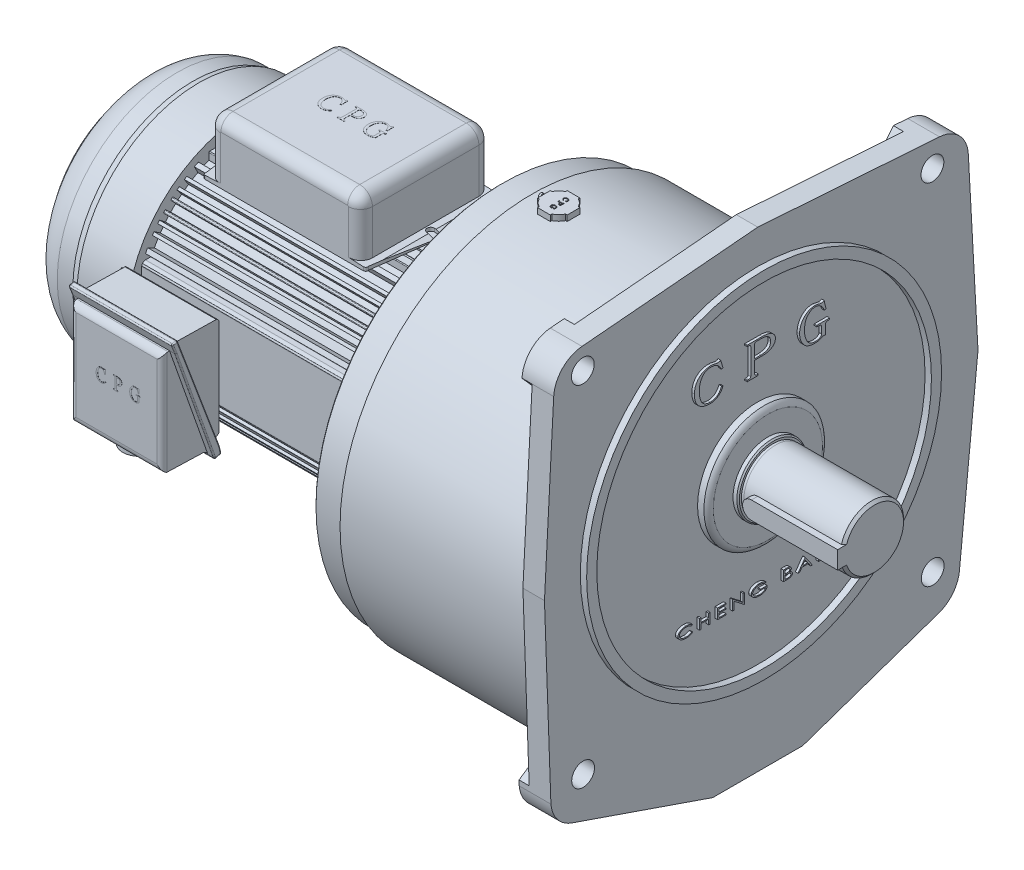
SolidWorks part; units mm, degrees
ref_plane "前基準面" through (0, 0, 0) normal (0, 0, 1) x (1, 0, 0)
ref_plane "上基準面" through (0, 0, 0) normal (0, 1, 0) x (1, 0, 0)
ref_plane "右基準面" through (0, 0, 0) normal (1, 0, 0) x (0, 0, -1)
sketch "草圖2" plane through (0, 0, 0) normal (0, 0, 1) x (1, 0, 0)
  line L0 (-161, 151.5439) -> (0, 151.5439)
  line L1 (-161, 151.5439) -> (-161, 146.5067)
  line L2 (-471, 0) -> (-471, 177.4974) construction
  line L3 (0, 0) -> (0, 151.5439)
  line L4 (-162, 147.5067) -> (-161, 146.5067)
  line L5 (-185, 146.5067) -> (-185, 124.0067)
  line L6 (-189, 123.0067) -> (-189, 105.0067)
  line L7 (-190.5, 104.0067) -> (-190.5, 90.2537)
  line L8 (-193, 90.2537) -> (-193, 83)
  line L9 (-189, 105.0067) -> (-189.5, 105.0067)
  line L10 (-189.5, 105.0067) -> (-190.5, 104.0067)
  line L11 (-190.5, 90.2537) -> (-193, 90.2537)
  line L12 (-188, 124.0067) -> (-189, 123.0067)
  line L13 (-185, 124.0067) -> (-188, 124.0067)
  line L14 (-184, 147.5067) -> (-185, 146.5067)
  line L15 (-162, 147.5067) -> (-184, 147.5067)
  line L16 (-471, 69) -> (-471, 0)
  line L17 (-204.5, 90) -> (-385, 90)
  line L18 (-385, 96) -> (-424, 96)
  line L19 (-428.8759, 94.5) -> (-441.1259, 94.5)
  line L20 (-428.8759, 94.5) -> (-424, 96)
  line L21 (-385, 96) -> (-385, 90)
  line L22 (-194, 84) -> (-196.9708, 84)
  line L23 (-515.1227, 0) -> (41.2916, 0) construction
  line L24 (-471, 0) -> (0, 0)
  line L25 (-196.9708, 84) -> (-196.9708, 85)
  arc A0 (-441.1259, 94.5) -> (-467.5, 73) centre (-435.0679, 60.142) ccw
  arc A1 (-467.5, 73) -> (-471, 69) centre (-467.2706, 69.2681) ccw
  arc A3 (-193, 83) -> (-194, 84) centre (-194, 83) ccw
  arc A4 (-204.5, 90) -> (-196.9708, 85) centre (-204.3616, 82.0396) cw
  dimension "D1" = 192
  dimension "D2" = 192
  dimension "D3" = 86
  dimension "D4" = 193
revolve "旋轉1" add sketch "草圖2" angle 360 about L23
sketch "草圖5" plane through (0, 0, 0) normal (1, 0, 0) x (0, 0, -1)
  line L0 (-260.2741, 51) -> (337.3159, 51) construction
  line L1 (166.0988, 184.8249) -> (173.7337, 46.8699)
  line L2 (-168.2663, 46.8699) -> (-163.1792, -94.766)
  line L3 (173.7337, 46.8699) -> (159.0195, -97.1828)
  line L4 (0, 0) -> (0, -245.4677) construction
  line L5 (0, 217.8699) -> (-138.6589, 205.7388)
  line L6 (-168.2663, 46.8699) -> (-160.9885, 182.6434)
  line L7 (0, 51) -> (-138, 188.7716) construction
  line L8 (0, 217.8699) -> (143.3342, 207.9121)
  line L9 (-286.7543, 0) -> (309.9532, 0) construction
  line L10 (0, 251.9137) -> (0, 51) construction
  line L14 (35.5, -154.1301) -> (-35.5, -154.1301)
  line L15 (-146.7463, -115.8249) -> (-35.5, -154.1301)
  line L16 (142.6964, -117.2194) -> (35.5, -154.1301)
  circle A0 centre (-138, 188.7716) radius 9
  circle A1 centre (0, 51) radius 195 construction
  circle A2 centre (137.7716, 189) radius 9
  circle A3 centre (138, -86.7716) radius 9
  circle A4 centre (-137.7716, -87) radius 9
  arc A5 (-138.6589, 205.7388) -> (-160.9885, 182.6434) centre (-136.5236, 181.332) ccw
  arc A6 (-163.1792, -94.766) -> (-146.7463, -115.8249) centre (-138.7699, -92.6597) ccw
  arc A7 (159.0195, -97.1828) -> (142.6964, -117.2194) centre (134.72, -94.0542) cw
  arc A8 (143.3342, 207.9121) -> (166.0988, 184.8249) centre (141.6362, 183.471) cw
  dimension "D4" = 18
  dimension "D5" = 24.5
  dimension "D3" = 390
  dimension "D2" = 342
  dimension "D9" = 372
  dimension "D11" = 138
ref_plane "平面1" through (0, 51, 0) normal (0, 1, 0) x (-1, 0, 0)
extrude "伸長1" add sketch "草圖5" along normal blind 17
sketch "草圖6" plane through (17, 0, 0) normal (1, 0, 0) x (0, 0, -1)
  circle A0 centre (0, 51) radius 140
  circle A1 centre (0, 51) radius 132
  dimension "D1" = 280
  dimension "D2" = 264
extrude "伸長2" add sketch "草圖6" along normal blind 5
sketch "草圖7" plane through (0, 0, 0) normal (0, 0, 1) x (1, 0, 0)
  line L0 (109, 51) -> (130.8468, 51) construction
  line L1 (31, 76) -> (106.985, 76)
  line L2 (106.985, 76) -> (31, 76)
  line L3 (22, 98.5) -> (17, 98.5)
  line L4 (29, 75.9) -> (29, 77.5)
  line L5 (31, 75.9) -> (31, 76)
  line L6 (24.985, 94.0279) -> (24.985, 78.5)
  line L7 (29, 75.9) -> (31, 75.9)
  line L8 (31, 75.9) -> (29, 75.9)
  line L9 (29, 77.5) -> (29, 75.9)
  line L10 (28, 78.5) -> (29, 77.5)
  line L11 (24.985, 78.5) -> (28, 78.5)
  line L12 (29, 77.5) -> (28, 78.5)
  line L13 (28, 78.5) -> (24.985, 78.5)
  line L14 (31, 75.9) -> (31, 76)
  line L15 (109, 51) -> (109, 74)
  line L16 (106.985, 76) -> (109, 74)
  line L17 (109, 74) -> (106.985, 76)
  line L18 (17, 46.8699) -> (17, 182.6434) construction
  line L20 (17, 98.5) -> (17, 51)
  line L22 (17, 51) -> (109, 51)
  line L23 (17, 217.8699) -> (17, 207.9121) construction
  line L25 (0, 151.5439) -> (0, -151.5439) construction
  arc A0 (24.985, 94.0279) -> (22, 98.5) centre (17.9603, 92.5714) ccw
  point P20 (0, 0)
  dimension "D1" = 50
  dimension "D2" = 80
  dimension "D3" = 92
  dimension "D4" = 51
  dimension "D5" = 55
revolve "旋轉2" add sketch "草圖7" angle 360 about L0
sketch "草圖12"
extrude "伸長7" add sketch "草圖12" along normal blind 2
sketch "草圖13" plane through (0, 0, 0) normal (-1, 0, 0) x (0, 0, 1)
  line L0 (-166.0988, 184.8249) -> (-101.5392, 112.496)
  line L1 (-131.988, 208.7004) -> (-72.023, 133.3351)
  line L2 (0, 217.8699) -> (-143.3342, 207.9121) construction
  line L3 (160.9885, 182.6434) -> (100.4476, 113.4718)
  line L4 (127.6635, 206.7008) -> (69.6783, 134.5752)
  line L5 (0, 217.8699) -> (138.6589, 205.7388) construction
  line L6 (-142.6964, -117.2194) -> (-117.1838, -96.0912)
  line L7 (-160.0698, -86.8998) -> (-135.2344, -68.3903)
  line L8 (-173.7337, 46.8699) -> (-159.0195, -97.1828) construction
  line L9 (146.7463, -115.8249) -> (117.1838, -96.0912)
  line L10 (163.3273, -90.6426) -> (134.1014, -70.586)
  line L12 (168.2663, 46.8699) -> (163.1792, -94.766) construction
  line L13 (163.3273, -90.6426) -> (163.1792, -94.766)
  line L14 (-160.0698, -86.8998) -> (-159.0195, -97.1828)
  line L15 (-131.988, 208.7004) -> (-143.3342, 207.9121)
  line L16 (127.6635, 206.7008) -> (138.6589, 205.7388)
  circle A0 centre (0, 0) radius 151.5439 construction
  circle A1 centre (0, 0) radius 151.5439 construction
  arc A2 (146.7463, -115.8249) -> (163.1792, -94.766) centre (138.7699, -92.6597) ccw construction
  arc A3 (-159.0195, -97.1828) -> (-142.6964, -117.2194) centre (-134.72, -94.0542) ccw construction
  arc A4 (146.7463, -115.8249) -> (163.1792, -94.766) centre (138.7699, -92.6597) ccw
  arc A5 (-159.0195, -97.1828) -> (-142.6964, -117.2194) centre (-134.72, -94.0542) ccw
  arc A6 (-143.3342, 207.9121) -> (-166.0988, 184.8249) centre (-141.6362, 183.471) ccw construction
  arc A7 (160.9885, 182.6434) -> (138.6589, 205.7388) centre (136.5236, 181.332) ccw construction
  arc A8 (-143.3342, 207.9121) -> (-166.0988, 184.8249) centre (-141.6362, 183.471) ccw
  arc A9 (160.9885, 182.6434) -> (138.6589, 205.7388) centre (136.5236, 181.332) ccw
  arc A10 (117.1838, -96.0912) -> (134.1014, -70.586) centre (0, 0) ccw
  arc A11 (100.4476, 113.4718) -> (69.6783, 134.5752) centre (0, 0) ccw
  arc A12 (-72.023, 133.3351) -> (-101.5392, 112.496) centre (0, 0) ccw
  arc A13 (-135.2344, -68.3903) -> (-117.1838, -96.0912) centre (0, 0) ccw
  circle A17 centre (-137.7716, 189) radius 9 construction
  circle A18 centre (-137.7716, 189) radius 9
  circle A19 centre (138, 188.7716) radius 9 construction
  circle A21 centre (138, 188.7716) radius 9
  circle A22 centre (137.7716, -87) radius 9 construction
  circle A23 centre (137.7716, -87) radius 9
  circle A24 centre (-138, -86.7716) radius 9 construction
  circle A25 centre (-138, -86.7716) radius 9
extrude "伸長13" add sketch "草圖13" along normal blind 8
ref_plane "平面5" through (0, 0, 0) normal (0, 0.5736, 0.8192) x (1, 0, 0)
sketch "草圖17" plane through (0, 0, 0) normal (0, 0.5736, 0.8192) x (1, 0, 0)
  line L0 (-8, 150.5324) -> (-8, 246.6625) construction
  arc A0 (-8, 198.5975) -> (-64.3921, 150.1512) centre (-78.6138, 223.7492) cw
rib "肋材1" sketch "草圖17" sketch "草圖17" thickness 13 extrusion direction parallel to sketch draft on no parameters "D1"=13
pattern_circular "環狀複製排列1" count 2 every 70 about axis through (-515.1227, 0, 0) along (-1, 0, 0) of "肋材1"
sketch "草圖19" plane through (0, 0, 0) normal (0, 0, 1) x (1, 0, 0)
  line L0 (-12.8358, 51) -> (184.7096, 51) construction
  line L1 (109, 28) -> (109, 74) construction
  line L2 (109, 44) -> (109, 58)
  line L3 (163, 51) -> (163, 90.2692) construction
  line L4 (109, 58) -> (41, 58)
  line L5 (41, 44) -> (109, 44)
  line L7 (34, 51) -> (34, 91.2981) construction
  arc A0 (41, 58) -> (41, 44) centre (41, 51) ccw
  dimension "D1" = 25
  dimension "D2" = 54
  dimension "D3" = 75
  dimension "D4" = 14
  dimension "D5" = 7
extrude "伸長14" add sketch "草圖19" along normal blind 29
ref_plane "平面6" through (0, 0, 146) normal (0, 0, 1) x (1, 0, 0)
sketch "草圖30" plane through (-385, 0, 0) normal (1, 0, 0) x (0, 0, -1)
  line L1 (83.9768, 30.5) -> (84, 25)
  line L2 (-77, -35) -> (-81, -35)
  line L3 (-84, 32) -> (-84, -32)
  line L4 (-25, 84) -> (-30.5, 83.9768)
  line L5 (-62.6347, 55.9723) -> (-66.5649, 59.6246)
  line L6 (-55.5337, 63.0239) -> (-59.1584, 66.9796)
  line L7 (62.6347, 55.9723) -> (66.5649, 59.6246)
  line L8 (55.5337, 63.0239) -> (59.1584, 66.9796)
  line L9 (-27.5, 81.5193) -> (-27.5, 81.2182)
  line L10 (-25, 82.6949) -> (-25, 84)
  line L11 (-22.1319, 82.4238) -> (-27.2473, 81.0252)
  line L13 (-25, 82.6949) -> (-27.1545, 81.9949)
  line L14 (82.739, -14.5) -> (83, -14.5)
  line L15 (-21.5, 81.2019) -> (-21.5, 81.9415)
  line L16 (30.408, 84.0542) -> (25, 84.0542)
  line L17 (27.5, 81.5193) -> (27.5, 81.2182)
  line L18 (25, 82.6949) -> (25, 84.0542)
  line L19 (22.1319, 82.4238) -> (27.2473, 81.0252)
  line L21 (25, 82.6949) -> (27.1545, 81.9949)
  line L22 (21.5, 81.2019) -> (21.5, 81.9415)
  line L23 (14.5, 84) -> (-14.5, 84)
  line L24 (-31, 78.0705) -> (-31, 83.3161)
  line L25 (31, 78.0705) -> (31, 83.3161)
  line L26 (75.5776, -36.661) -> (80.7713, -39.3073)
  line L27 (74.0184, -39.715) -> (79.1538, -42.3316)
  line L28 (79.1992, -43.5009) -> (79.4037, -43.0999)
  line L29 (84.0275, -42.8059) -> (84.0275, -39.8699)
  line L30 (81.8736, -38.1763) -> (81.4878, -38.9531)
  line L31 (-14.5, 82.739) -> (-14.5, 84)
  line L32 (14.5, 82.739) -> (14.5, 84)
  line L33 (82.6871, -44.1437) -> (84.0275, -42.8059)
  line L34 (81.5193, 27.5) -> (81.2182, 27.5)
  line L35 (82.6949, 25) -> (84, 25)
  line L36 (82.4238, 22.1319) -> (81.0252, 27.2473)
  line L38 (82.6949, 25) -> (81.9949, 27.1545)
  line L39 (81.2019, 21.5) -> (81.9415, 21.5)
  line L40 (-50.8384, 76.0382) -> (-49.9098, 76.9669)
  line L41 (-56.0389, 70.8378) -> (-55.1225, 71.7541)
  line L42 (-71.3069, 55.5698) -> (-70.3913, 56.4854)
  line L43 (-76.5076, 50.3691) -> (-75.5802, 51.2964)
  line L44 (-69.2435, 47.5535) -> (-74.9493, 51.3588)
  line L45 (-76.4314, 49.5995) -> (-70.5119, 45.6517)
  line L46 (-65.2067, 52.9536) -> (-69.7278, 56.5242)
  line L47 (-71.2632, 54.8238) -> (-66.6235, 51.1596)
  line L48 (-50.6933, 66.9791) -> (-54.3744, 71.7077)
  line L49 (-56.0799, 70.1771) -> (-52.4971, 65.5748)
  line L50 (-45.1583, 70.8289) -> (-49.1383, 76.8878)
  line L51 (-50.9028, 75.4102) -> (-47.069, 69.5738)
  line L52 (50.8384, 76.0382) -> (49.9098, 76.9669)
  line L53 (56.0389, 70.8378) -> (55.1225, 71.7541)
  line L54 (71.3069, 55.5698) -> (70.3913, 56.4854)
  line L55 (36.661, -75.5776) -> (39.3073, -80.7713)
  line L56 (39.715, -74.0184) -> (42.3316, -79.1538)
  line L57 (43.5009, -79.1992) -> (43.0999, -79.4037)
  line L58 (42.8766, -84) -> (39.8641, -84)
  line L59 (38.1763, -81.8736) -> (38.9531, -81.4878)
  line L60 (76.5076, 50.3691) -> (75.5802, 51.2964)
  line L61 (37.9124, -82.4376) -> (37.9189, -82.4649)
  line L62 (44.2145, -82.6597) -> (42.8766, -84)
  line L63 (-36.661, -75.5776) -> (-39.3073, -80.7713)
  line L64 (-39.715, -74.0184) -> (-42.3316, -79.1538)
  line L65 (-43.5009, -79.1992) -> (-43.0999, -79.4037)
  line L66 (-42.8766, -84) -> (-39.8641, -84)
  line L67 (-38.1763, -81.8736) -> (-38.9531, -81.4878)
  line L68 (69.2435, 47.5535) -> (74.9493, 51.3588)
  line L69 (76.4314, 49.5995) -> (70.5119, 45.6517)
  line L70 (-44.2145, -82.6597) -> (-42.8766, -84)
  line L71 (65.2067, 52.9536) -> (69.7278, 56.5242)
  line L72 (71.2632, 54.8238) -> (66.6235, 51.1596)
  line L73 (50.6933, 66.9791) -> (54.3744, 71.7077)
  line L74 (56.0799, 70.1771) -> (52.4971, 65.5748)
  line L75 (45.1583, 70.8289) -> (49.1383, 76.8878)
  line L76 (50.9028, 75.4102) -> (47.069, 69.5738)
  line L77 (78.0705, 31) -> (83.2619, 31)
  line L78 (-82.6871, 44.2202) -> (-84.0275, 42.8824)
  line L79 (-75.5776, -36.661) -> (-80.7713, -39.3073)
  line L80 (-74.0184, -39.715) -> (-79.1538, -42.3316)
  line L81 (-79.1992, -43.5009) -> (-79.4037, -43.0999)
  line L82 (-84.0275, -42.8824) -> (-84.0275, -39.8699)
  line L83 (-81.8736, -38.1763) -> (-81.4878, -38.9531)
  line L84 (-81.8736, 38.1763) -> (-81.4878, 38.9531)
  line L85 (-84.0275, 42.8824) -> (-84.0275, 39.8699)
  line L86 (-82.6871, -44.2202) -> (-84.0275, -42.8824)
  line L87 (78.0705, -31) -> (83.2619, -31)
  line L88 (84, 13.5) -> (84, -13.5)
  line L89 (-79.1992, 43.5009) -> (-79.4037, 43.0999)
  line L90 (-74.0184, 39.715) -> (-79.1538, 42.3316)
  line L91 (50.9028, -75.4102) -> (47.069, -69.5738)
  line L92 (45.1583, -70.8289) -> (49.1383, -76.8878)
  line L93 (56.0799, -70.1771) -> (52.4971, -65.5748)
  line L94 (50.6933, -66.9791) -> (54.3744, -71.7077)
  line L95 (71.2632, -54.8238) -> (66.6235, -51.1596)
  line L96 (65.2067, -52.9536) -> (69.7278, -56.5242)
  line L97 (76.4314, -49.5995) -> (70.5119, -45.6517)
  line L98 (69.2435, -47.5535) -> (74.9493, -51.3588)
  line L99 (76.5076, -50.3691) -> (75.5802, -51.2964)
  line L100 (71.3069, -55.5698) -> (70.3913, -56.4854)
  line L101 (56.0389, -70.8378) -> (55.1225, -71.7541)
  line L102 (50.8384, -76.0382) -> (49.9098, -76.9669)
  line L103 (-75.5776, 36.661) -> (-80.7713, 39.3073)
  line L104 (-44.2145, 82.6597) -> (-42.8766, 84)
  line L105 (-38.1763, 81.8736) -> (-38.9531, 81.4878)
  line L106 (-42.8766, 84) -> (-39.8641, 84)
  line L107 (-43.5009, 79.1992) -> (-43.0999, 79.4037)
  line L108 (-39.715, 74.0184) -> (-42.3316, 79.1538)
  line L109 (-36.661, 75.5776) -> (-39.3073, 80.7713)
  line L110 (44.2145, 82.6597) -> (42.8766, 84)
  line L111 (37.9124, 82.4376) -> (37.9189, 82.4649)
  line L112 (38.1763, 81.8736) -> (38.9531, 81.4878)
  line L113 (42.8766, 84) -> (39.8641, 84)
  line L114 (43.5009, 79.1992) -> (43.0999, 79.4037)
  line L115 (-50.9028, -75.4102) -> (-47.069, -69.5738)
  line L116 (-45.1583, -70.8289) -> (-49.1383, -76.8878)
  line L117 (-56.0799, -70.1771) -> (-52.4971, -65.5748)
  line L118 (-50.6933, -66.9791) -> (-54.3744, -71.7077)
  line L119 (-71.2632, -54.8238) -> (-66.6235, -51.1596)
  line L120 (-65.2067, -52.9536) -> (-69.7278, -56.5242)
  line L121 (-76.4314, -49.5995) -> (-70.5119, -45.6517)
  line L122 (-69.2435, -47.5535) -> (-74.9493, -51.3588)
  line L123 (-76.5076, -50.3691) -> (-75.5802, -51.2964)
  line L124 (-71.3069, -55.5698) -> (-70.3913, -56.4854)
  line L125 (-56.0389, -70.8378) -> (-55.1225, -71.7541)
  line L126 (-50.8384, -76.0382) -> (-49.9098, -76.9669)
  line L127 (39.715, 74.0184) -> (42.3316, 79.1538)
  line L128 (36.661, 75.5776) -> (39.3073, 80.7713)
  line L129 (82.6871, 44.1437) -> (84.0275, 42.8059)
  line L130 (81.8736, 38.1763) -> (81.4878, 38.9531)
  line L131 (84.0275, 42.8059) -> (84.0275, 39.8699)
  line L132 (79.1992, 43.5009) -> (79.4037, 43.0999)
  line L133 (74.0184, 39.715) -> (79.1538, 42.3316)
  line L134 (75.5776, 36.661) -> (80.7713, 39.3073)
  line L135 (81.2019, -21.5) -> (81.9415, -21.5)
  line L136 (82.6949, -25) -> (81.9949, -27.1545)
  line L137 (82.6949, -25) -> (84, -25)
  line L138 (82.4238, -22.1319) -> (81.0252, -27.2473)
  line L140 (81.5193, -27.5) -> (81.2182, -27.5)
  line L141 (82.739, 14.5) -> (83, 14.5)
  line L142 (-77, 35) -> (-81, 35)
  line L163 (14.5, -82.739) -> (14.5, -84)
  line L165 (-14.5, -82.739) -> (-14.5, -84)
  line L166 (31, -78.0705) -> (31, -83.3161)
  line L168 (-31, -78.0705) -> (-31, -83.3161)
  line L169 (14.5, -84) -> (-14.5, -84)
  line L170 (21.5, -81.2019) -> (21.5, -81.9415)
  line L171 (25, -82.6949) -> (27.1545, -81.9949)
  line L172 (25, -82.6949) -> (25, -84.0542)
  line L173 (22.1319, -82.4238) -> (27.2473, -81.0252)
  line L176 (27.5, -81.5193) -> (27.5, -81.2182)
  line L177 (30.408, -84.0542) -> (25, -84.0542)
  line L178 (-21.5, -81.2019) -> (-21.5, -81.9415)
  line L179 (-25, -82.6949) -> (-27.1545, -81.9949)
  line L180 (-25, -82.6949) -> (-25, -84)
  line L181 (-22.1319, -82.4238) -> (-27.2473, -81.0252)
  line L183 (-27.5, -81.5193) -> (-27.5, -81.2182)
  line L192 (55.5337, -63.0239) -> (59.1584, -66.9796)
  line L193 (62.6347, -55.9723) -> (66.5649, -59.6246)
  line L207 (-55.5337, -63.0239) -> (-59.1584, -66.9796)
  line L208 (-62.6347, -55.9723) -> (-66.5649, -59.6246)
  line L210 (-25, -84) -> (-30.5, -83.9768)
  line L211 (83.9768, -30.5) -> (84, -25)
  arc A0 (-65.7342, 61.1578) -> (-64.8864, 61.1066) centre (-65.3262, 60.8687) cw
  arc A1 (-61.0998, 57.6667) -> (-64.8864, 61.1066) centre (-58.0918, 64.782) cw
  arc A2 (-65.7342, 61.1578) -> (-66.5042, 60.4053) centre (-68.1819, 62.8923) cw
  arc A3 (-76.0941, -35.5765) -> (-77, -35) centre (-77, -36) ccw
  arc A4 (-84, -32) -> (-81, -35) centre (-81, -32) ccw
  arc A5 (-66.5649, 59.6246) -> (-66.5042, 60.4053) centre (-66.2246, 59.9908) cw
  circle A6 centre (0, 0) radius 94.5411
  arc A8 (-60.6659, 65.3244) -> (-60.7112, 66.1725) centre (-60.425, 65.7625) cw
  arc A9 (-61.0998, 57.6667) -> (-57.2525, 61.5139) centre (0.1888, 0.2236) cw
  arc A10 (-60.6659, 65.3244) -> (-57.2525, 61.5139) centre (-64.3887, 58.5556) cw
  arc A11 (-59.9396, 66.9243) -> (-60.7112, 66.1725) centre (-62.3849, 68.6623) cw
  arc A12 (-59.9396, 66.9243) -> (-59.1584, 66.9796) centre (-59.527, 66.6418) cw
  arc A13 (64.8864, 61.1066) -> (65.7342, 61.1578) centre (65.3262, 60.8687) cw
  arc A14 (79.4037, -43.0999) -> (79.1538, -42.3316) centre (78.8943, -42.8408) ccw
  arc A15 (80.7713, -39.3073) -> (81.4878, -38.9531) centre (80.8388, -38.542) ccw
  arc A16 (84.0275, -39.8699) -> (82.4376, -37.9124) centre (82.0275, -39.8699) ccw
  arc A17 (82.4376, -37.9124) -> (81.8736, -38.1763) centre (82.3214, -38.3987) ccw
  arc A18 (79.7871, -44.8283) -> (82.6871, -44.1437) centre (80.6745, -42.1025) ccw
  arc A19 (79.1992, -43.5009) -> (79.7871, -44.8283) centre (80.122, -43.8861) ccw
  arc A20 (64.8864, 61.1066) -> (61.0998, 57.6667) centre (58.0918, 64.782) cw
  arc A21 (66.5042, 60.4053) -> (65.7342, 61.1578) centre (68.1819, 62.8923) cw
  arc A22 (66.5042, 60.4053) -> (66.5649, 59.6246) centre (66.2246, 59.9908) cw
  arc A25 (60.7112, 66.1725) -> (60.6659, 65.3244) centre (60.425, 65.7625) cw
  arc A26 (57.2525, 61.5139) -> (61.0998, 57.6667) centre (-0.1888, 0.2236) cw
  arc A27 (57.2525, 61.5139) -> (60.6659, 65.3244) centre (64.3887, 58.5556) cw
  arc A28 (60.7112, 66.1725) -> (59.9396, 66.9243) centre (62.3849, 68.6623) cw
  arc A29 (59.1584, 66.9796) -> (59.9396, 66.9243) centre (59.527, 66.6418) cw
  arc A30 (83, 14.5) -> (84, 13.5) centre (83, 13.5) cw
  arc A31 (81.2019, 21.5) -> (82.739, 14.5) centre (0, 0) cw
  arc A32 (75.5776, 36.661) -> (78.0705, 31) centre (0, 0) cw
  arc A33 (70.5119, 45.6517) -> (74.0184, 39.715) centre (0, 0) cw
  arc A34 (66.6235, 51.1596) -> (69.2435, 47.5535) centre (0, 0) cw
  arc A35 (62.6347, 55.9723) -> (65.2067, 52.9536) centre (0, 0) cw
  arc A36 (52.4971, 65.5748) -> (55.5337, 63.0239) centre (0, 0) cw
  arc A37 (47.069, 69.5738) -> (50.6933, 66.9791) centre (0, 0) cw
  arc A38 (39.715, 74.0184) -> (45.1583, 70.8289) centre (0, 0) cw
  arc A39 (31, 78.0705) -> (36.661, 75.5776) centre (0, 0) cw
  arc A40 (42.3316, -79.1538) -> (43.0999, -79.4037) centre (42.8408, -78.8943) ccw
  arc A41 (38.9531, -81.4878) -> (39.3073, -80.7713) centre (38.542, -80.8388) ccw
  arc A42 (37.9189, -82.4649) -> (39.8641, -84) centre (39.8641, -82) ccw
  arc A43 (38.1763, -81.8736) -> (37.9124, -82.4376) centre (38.3987, -82.3214) ccw
  arc A44 (44.2145, -82.6597) -> (44.899, -79.7596) centre (42.1733, -80.647) ccw
  arc A45 (44.899, -79.7596) -> (43.5009, -79.1992) centre (43.9552, -80.09) ccw
  arc A46 (-43.0999, -79.4037) -> (-42.3316, -79.1538) centre (-42.8408, -78.8943) ccw
  arc A47 (-39.3073, -80.7713) -> (-38.9531, -81.4878) centre (-38.542, -80.8388) ccw
  arc A48 (-39.8641, -84) -> (-37.9066, -82.4101) centre (-39.8641, -82) ccw
  arc A49 (-37.9066, -82.4101) -> (-38.1763, -81.8736) centre (-38.3987, -82.3214) ccw
  arc A50 (-44.899, -79.7596) -> (-44.2145, -82.6597) centre (-42.1733, -80.647) ccw
  arc A51 (-43.5009, -79.1992) -> (-44.899, -79.7596) centre (-43.9552, -80.09) ccw
  arc A52 (14.5, 82.739) -> (21.5, 81.2019) centre (0, 0) cw
  arc A53 (-21.5, 81.2019) -> (-14.5, 82.739) centre (0, 0) cw
  arc A54 (-36.661, 75.5776) -> (-31, 78.0705) centre (0, 0) cw
  arc A55 (-45.1583, 70.8289) -> (-39.715, 74.0184) centre (0, 0) cw
  arc A56 (-50.6933, 66.9791) -> (-47.069, 69.5738) centre (0, 0) cw
  arc A57 (-55.5337, 63.0239) -> (-52.4971, 65.5748) centre (0, 0) cw
  arc A58 (-79.1538, -42.3316) -> (-79.4037, -43.0999) centre (-78.8943, -42.8408) ccw
  arc A59 (-81.4878, -38.9531) -> (-80.7713, -39.3073) centre (-80.8388, -38.542) ccw
  arc A60 (-82.4376, -37.9124) -> (-84.0275, -39.8699) centre (-82.0275, -39.8699) ccw
  arc A61 (-81.8736, -38.1763) -> (-82.4376, -37.9124) centre (-82.3214, -38.3987) ccw
  arc A62 (-82.6871, -44.2202) -> (-79.7871, -44.9048) centre (-80.6745, -42.179) ccw
  arc A63 (-79.7871, -44.9048) -> (-79.1992, -43.5009) centre (-80.0915, -43.9523) ccw
  arc A64 (83.2619, -31) -> (83.9768, -30.5) centre (83.289, -30.2777) ccw
  arc A65 (74.9493, -51.3588) -> (75.5802, -51.2964) centre (75.2267, -50.9428) ccw
  arc A66 (76.5076, -50.3691) -> (76.4314, -49.5995) centre (76.154, -50.0155) ccw
  arc A67 (69.7278, -56.5242) -> (70.3913, -56.4854) centre (70.0377, -56.1318) ccw
  arc A68 (71.3069, -55.5698) -> (71.2632, -54.8238) centre (70.9533, -55.2162) ccw
  arc A69 (54.3744, -71.7077) -> (55.1225, -71.7541) centre (54.769, -71.4006) ccw
  arc A70 (56.0389, -70.8378) -> (56.0799, -70.1771) centre (55.6853, -70.4842) ccw
  arc A71 (49.1383, -76.8878) -> (49.9098, -76.9669) centre (49.5562, -76.6133) ccw
  arc A72 (50.8384, -76.0382) -> (50.9028, -75.4102) centre (50.4849, -75.6847) ccw
  arc A73 (-65.2067, 52.9536) -> (-62.6347, 55.9723) centre (0, 0) cw
  arc A74 (-69.2435, 47.5535) -> (-66.6235, 51.1596) centre (0, 0) cw
  arc A75 (-74.0184, 39.715) -> (-70.5119, 45.6517) centre (0, 0) cw
  arc A76 (-76.0941, 35.5765) -> (-75.5776, 36.661) centre (0, 0) cw
  arc A77 (-27.5, 81.5193) -> (-27.1545, 81.9949) centre (-27, 81.5193) cw
  arc A78 (-27.2473, 81.0252) -> (-27.5, 81.2182) centre (-27.3, 81.2182) cw
  arc A79 (-22.1319, 82.4238) -> (-21.5, 81.9415) centre (-22, 81.9415) cw
  arc A80 (27.1545, 81.9949) -> (27.5, 81.5193) centre (27, 81.5193) cw
  arc A81 (-75.5802, -51.2964) -> (-74.9493, -51.3588) centre (-75.2267, -50.9428) ccw
  arc A82 (-76.4314, -49.5995) -> (-76.5076, -50.3691) centre (-76.154, -50.0155) ccw
  arc A83 (-70.3913, -56.4854) -> (-69.7278, -56.5242) centre (-70.0377, -56.1318) ccw
  arc A84 (-71.2632, -54.8238) -> (-71.3069, -55.5698) centre (-70.9533, -55.2162) ccw
  arc A85 (-55.1225, -71.7541) -> (-54.3744, -71.7077) centre (-54.769, -71.4006) ccw
  arc A86 (-56.0799, -70.1771) -> (-56.0389, -70.8378) centre (-55.6853, -70.4842) ccw
  arc A87 (-49.9098, -76.9669) -> (-49.1383, -76.8878) centre (-49.5562, -76.6133) ccw
  arc A88 (-50.9028, -75.4102) -> (-50.8384, -76.0382) centre (-50.4849, -75.6847) ccw
  arc A89 (27.5, 81.2182) -> (27.2473, 81.0252) centre (27.3, 81.2182) cw
  arc A90 (21.5, 81.9415) -> (22.1319, 82.4238) centre (22, 81.9415) cw
  arc A91 (-31, 83.3161) -> (-30.5, 83.9768) centre (-30.2777, 83.289) cw
  arc A92 (82.4238, -22.1319) -> (81.9415, -21.5) centre (81.9415, -22) ccw
  arc A93 (81.0252, -27.2473) -> (81.2182, -27.5) centre (81.2182, -27.3) ccw
  arc A94 (81.5193, -27.5) -> (81.9949, -27.1545) centre (81.5193, -27) ccw
  arc A95 (30.408, 84.0542) -> (31, 83.3161) centre (30.2777, 83.3432) cw
  arc A96 (81.5193, 27.5) -> (81.9949, 27.1545) centre (81.5193, 27) cw
  arc A97 (81.0252, 27.2473) -> (81.2182, 27.5) centre (81.2182, 27.3) cw
  arc A98 (82.4238, 22.1319) -> (81.9415, 21.5) centre (81.9415, 22) cw
  arc A99 (-50.9028, 75.4102) -> (-50.8384, 76.0382) centre (-50.4849, 75.6847) cw
  arc A100 (-49.9098, 76.9669) -> (-49.1383, 76.8878) centre (-49.5562, 76.6133) cw
  arc A101 (-56.0799, 70.1771) -> (-56.0389, 70.8378) centre (-55.6853, 70.4842) cw
  arc A102 (-55.1225, 71.7541) -> (-54.3744, 71.7077) centre (-54.769, 71.4006) cw
  arc A103 (30.408, -84.0542) -> (31, -83.3161) centre (30.2777, -83.3432) ccw
  arc A104 (-31, -83.3161) -> (-30.5, -83.9768) centre (-30.2777, -83.289) ccw
  arc A105 (21.5, -81.9415) -> (22.1319, -82.4238) centre (22, -81.9415) ccw
  arc A106 (27.5, -81.2182) -> (27.2473, -81.0252) centre (27.3, -81.2182) ccw
  arc A107 (27.1545, -81.9949) -> (27.5, -81.5193) centre (27, -81.5193) ccw
  arc A108 (-22.1319, -82.4238) -> (-21.5, -81.9415) centre (-22, -81.9415) ccw
  arc A109 (-27.2473, -81.0252) -> (-27.5, -81.2182) centre (-27.3, -81.2182) ccw
  arc A110 (-27.5, -81.5193) -> (-27.1545, -81.9949) centre (-27, -81.5193) ccw
  arc A111 (-71.2632, 54.8238) -> (-71.3069, 55.5698) centre (-70.9533, 55.2162) cw
  arc A112 (-70.3913, 56.4854) -> (-69.7278, 56.5242) centre (-70.0377, 56.1318) cw
  arc A113 (-76.4314, 49.5995) -> (-76.5076, 50.3691) centre (-76.154, 50.0155) cw
  arc A114 (-75.5802, 51.2964) -> (-74.9493, 51.3588) centre (-75.2267, 50.9428) cw
  arc A115 (50.8384, 76.0382) -> (50.9028, 75.4102) centre (50.4849, 75.6847) cw
  arc A116 (49.1383, 76.8878) -> (49.9098, 76.9669) centre (49.5562, 76.6133) cw
  arc A117 (56.0389, 70.8378) -> (56.0799, 70.1771) centre (55.6853, 70.4842) cw
  arc A118 (54.3744, 71.7077) -> (55.1225, 71.7541) centre (54.769, 71.4006) cw
  arc A119 (71.3069, 55.5698) -> (71.2632, 54.8238) centre (70.9533, 55.2162) cw
  arc A120 (69.7278, 56.5242) -> (70.3913, 56.4854) centre (70.0377, 56.1318) cw
  arc A121 (76.5076, 50.3691) -> (76.4314, 49.5995) centre (76.154, 50.0155) cw
  arc A122 (74.9493, 51.3588) -> (75.5802, 51.2964) centre (75.2267, 50.9428) cw
  arc A123 (83.2619, 31) -> (83.9768, 30.5) centre (83.289, 30.2777) cw
  arc A124 (-79.7871, 44.9048) -> (-79.1992, 43.5009) centre (-80.0915, 43.9523) cw
  arc A125 (-82.6871, 44.2202) -> (-79.7871, 44.9048) centre (-80.6745, 42.179) cw
  arc A126 (-76.0941, -35.5765) -> (-75.5776, -36.661) centre (0, 0) ccw
  arc A127 (-81.8736, 38.1763) -> (-82.4376, 37.9124) centre (-82.3214, 38.3987) cw
  arc A128 (-74.0184, -39.715) -> (-70.5119, -45.6517) centre (0, 0) ccw
  arc A129 (-69.2435, -47.5535) -> (-66.6235, -51.1596) centre (0, 0) ccw
  arc A130 (-65.2067, -52.9536) -> (-62.6347, -55.9723) centre (0, 0) ccw
  arc A131 (-55.5337, -63.0239) -> (-52.4971, -65.5748) centre (0, 0) ccw
  arc A132 (-50.6933, -66.9791) -> (-47.069, -69.5738) centre (0, 0) ccw
  arc A133 (-45.1583, -70.8289) -> (-39.715, -74.0184) centre (0, 0) ccw
  arc A134 (-36.661, -75.5776) -> (-31, -78.0705) centre (0, 0) ccw
  arc A135 (-21.5, -81.2019) -> (-14.5, -82.739) centre (0, 0) ccw
  arc A136 (14.5, -82.739) -> (21.5, -81.2019) centre (0, 0) ccw
  arc A137 (31, -78.0705) -> (36.661, -75.5776) centre (0, 0) ccw
  arc A138 (39.715, -74.0184) -> (45.1583, -70.8289) centre (0, 0) ccw
  arc A139 (47.069, -69.5738) -> (50.6933, -66.9791) centre (0, 0) ccw
  arc A140 (52.4971, -65.5748) -> (55.5337, -63.0239) centre (0, 0) ccw
  arc A141 (62.6347, -55.9723) -> (65.2067, -52.9536) centre (0, 0) ccw
  arc A142 (66.6235, -51.1596) -> (69.2435, -47.5535) centre (0, 0) ccw
  arc A143 (70.5119, -45.6517) -> (74.0184, -39.715) centre (0, 0) ccw
  arc A144 (75.5776, -36.661) -> (78.0705, -31) centre (0, 0) ccw
  arc A145 (81.2019, -21.5) -> (82.739, -14.5) centre (0, 0) ccw
  arc A146 (-82.4376, 37.9124) -> (-84.0275, 39.8699) centre (-82.0275, 39.8699) cw
  arc A147 (-81.4878, 38.9531) -> (-80.7713, 39.3073) centre (-80.8388, 38.542) cw
  arc A148 (83, -14.5) -> (84, -13.5) centre (83, -13.5) ccw
  arc A149 (-79.1538, 42.3316) -> (-79.4037, 43.0999) centre (-78.8943, 42.8408) cw
  arc A150 (-43.5009, 79.1992) -> (-44.899, 79.7596) centre (-43.9552, 80.09) cw
  arc A151 (-44.899, 79.7596) -> (-44.2145, 82.6597) centre (-42.1733, 80.647) cw
  arc A152 (-37.9066, 82.4101) -> (-38.1763, 81.8736) centre (-38.3987, 82.3214) cw
  arc A153 (-39.8641, 84) -> (-37.9066, 82.4101) centre (-39.8641, 82) cw
  arc A154 (-39.3073, 80.7713) -> (-38.9531, 81.4878) centre (-38.542, 80.8388) cw
  arc A155 (-43.0999, 79.4037) -> (-42.3316, 79.1538) centre (-42.8408, 78.8943) cw
  arc A156 (44.899, 79.7596) -> (43.5009, 79.1992) centre (43.9552, 80.09) cw
  arc A157 (44.2145, 82.6597) -> (44.899, 79.7596) centre (42.1733, 80.647) cw
  arc A158 (38.1763, 81.8736) -> (37.9124, 82.4376) centre (38.3987, 82.3214) cw
  arc A159 (37.9189, 82.4649) -> (39.8641, 84) centre (39.8641, 82) cw
  arc A160 (38.9531, 81.4878) -> (39.3073, 80.7713) centre (38.542, 80.8388) cw
  arc A161 (42.3316, 79.1538) -> (43.0999, 79.4037) centre (42.8408, 78.8943) cw
  arc A162 (59.1584, -66.9796) -> (59.9396, -66.9243) centre (59.527, -66.6418) ccw
  arc A163 (60.7112, -66.1725) -> (59.9396, -66.9243) centre (62.3849, -68.6623) ccw
  arc A164 (57.2525, -61.5139) -> (60.6659, -65.3244) centre (64.3887, -58.5556) ccw
  arc A165 (57.2525, -61.5139) -> (61.0998, -57.6667) centre (-0.1888, -0.2236) ccw
  arc A166 (60.7112, -66.1725) -> (60.6659, -65.3244) centre (60.425, -65.7625) ccw
  arc A167 (64.8864, -61.1066) -> (61.0998, -57.6667) centre (58.0918, -64.782) ccw
  arc A168 (64.8864, -61.1066) -> (65.7342, -61.1578) centre (65.3262, -60.8687) ccw
  arc A169 (66.5042, -60.4053) -> (66.5649, -59.6246) centre (66.2246, -59.9908) ccw
  arc A170 (66.5042, -60.4053) -> (65.7342, -61.1578) centre (68.1819, -62.8923) ccw
  arc A173 (79.1992, 43.5009) -> (79.7871, 44.8283) centre (80.122, 43.8861) cw
  arc A174 (79.7871, 44.8283) -> (82.6871, 44.1437) centre (80.6745, 42.1025) cw
  arc A175 (82.4376, 37.9124) -> (81.8736, 38.1763) centre (82.3214, 38.3987) cw
  arc A176 (84.0275, 39.8699) -> (82.4376, 37.9124) centre (82.0275, 39.8699) cw
  arc A177 (80.7713, 39.3073) -> (81.4878, 38.9531) centre (80.8388, 38.542) cw
  arc A178 (79.4037, 43.0999) -> (79.1538, 42.3316) centre (78.8943, 42.8408) cw
  arc A179 (-84, 32) -> (-81, 35) centre (-81, 32) cw
  arc A180 (-76.0941, 35.5765) -> (-77, 35) centre (-77, 36) cw
  arc A195 (-59.9396, -66.9243) -> (-59.1584, -66.9796) centre (-59.527, -66.6418) ccw
  arc A196 (-59.9396, -66.9243) -> (-60.7112, -66.1725) centre (-62.3849, -68.6623) ccw
  arc A197 (-60.6659, -65.3244) -> (-57.2525, -61.5139) centre (-64.3887, -58.5556) ccw
  arc A198 (-61.0998, -57.6667) -> (-57.2525, -61.5139) centre (0.1888, -0.2236) ccw
  arc A199 (-60.6659, -65.3244) -> (-60.7112, -66.1725) centre (-60.425, -65.7625) ccw
  arc A200 (-61.0998, -57.6667) -> (-64.8864, -61.1066) centre (-58.0918, -64.782) ccw
  arc A201 (-65.7342, -61.1578) -> (-64.8864, -61.1066) centre (-65.3262, -60.8687) ccw
  arc A202 (-66.5649, -59.6246) -> (-66.5042, -60.4053) centre (-66.2246, -59.9908) ccw
  arc A203 (-65.7342, -61.1578) -> (-66.5042, -60.4053) centre (-68.1819, -62.8923) ccw
  point P429 (84, 0)
  point P447 (-84, 0)
extrude "伸長32" cut sketch "草圖30" along normal blind 186
sketch "草圖21" plane through (0, 0, 0) normal (0, 0, 1) x (1, 0, 0)
  line L1 (-385, -96) -> (-385, 96) construction
  line L8 (-245, 121.8767) -> (-245, 86.8767)
  line L9 (-245, 86.8767) -> (-239.7489, 86.6061)
  line L12 (-255, 131.9768) -> (-355, 131.9768)
  line L13 (-239.7489, 86.6061) -> (-235.0855, 84.8733)
  line L14 (-370.2511, 86.6061) -> (-375.0855, 84.8466)
  line L15 (-374.9145, 83.9768) -> (-235.0855, 83.9768)
  line L16 (-365, 86.8767) -> (-370.2511, 86.6061)
  line L17 (-365, 121.8767) -> (-365, 86.8767)
  arc A4 (-245, 121.8767) -> (-255, 131.9768) centre (-254.9995, 121.9768) ccw
  arc A5 (-235.0855, 83.9768) -> (-235.0855, 84.8733) centre (-235.3654, 84.425) ccw
  arc A6 (-374.9145, 83.9768) -> (-375.0855, 84.8466) centre (-374.7729, 84.4563) cw
  arc A7 (-365, 121.8767) -> (-355, 131.9768) centre (-355.0005, 121.9768) cw
  dimension "D2" = 140
  dimension "D1" = 120
  dimension "D3" = 48
  dimension "D4" = 20
extrude "伸長16" add sketch "草圖21" along normal mid plane 103 separate body
sketch "草圖22" plane through (0, 131.9768, 0) normal (0, 1, 0) x (-1, 0, 0)
  line L1 (305.0549, 62.8703) -> (305.0549, -67.6213) construction
  line L2 (375.2729, 3) -> (369.1201, 48.9679)
  line L3 (375.2729, -3) -> (369.1201, -48.9679)
  line L4 (369.2746, 3) -> (375.2729, 3)
  line L5 (234.8369, 51.5) -> (234.8369, -51.5) construction
  line L6 (369.2746, -3) -> (375.2729, -3)
  line L7 (255, 51.5) -> (355, 51.5) construction
  line L8 (375.2729, -51.5) -> (375.2729, 51.5)
  line L10 (367.6568, 51.5) -> (375.2729, 51.5)
  line L11 (367.6568, -51.5) -> (375.2729, -51.5)
  line L14 (355, -51.5) -> (365.0005, -51.5) construction
  line L15 (242.4531, -51.5) -> (234.8369, -51.5)
  line L16 (242.4531, 51.5) -> (234.8369, 51.5)
  line L17 (234.8369, -51.5) -> (234.8369, 51.5)
  line L18 (240.8352, -3) -> (234.8369, -3)
  line L19 (240.8352, 3) -> (234.8369, 3)
  line L20 (234.8369, -3) -> (240.9898, -48.9679)
  line L21 (234.8369, 3) -> (240.9898, 48.9679)
  line L26 (375.2729, -51.5) -> (375.2729, 51.5) construction
  arc A0 (369.1201, 48.9679) -> (367.6568, 51.5) centre (367.4128, 49.6702) ccw
  arc A1 (240.8352, 3) -> (240.8352, -3) centre (240.8352, 0) cw
  arc A2 (367.6568, -51.5) -> (369.1201, -48.9679) centre (367.4128, -49.6702) ccw
  arc A3 (242.4531, -51.5) -> (240.9898, -48.9679) centre (242.697, -49.6702) cw
  arc A4 (369.2746, 3) -> (369.2746, -3) centre (369.2746, 0) ccw
  arc A5 (240.9898, 48.9679) -> (242.4531, 51.5) centre (242.697, 49.6702) cw
extrude "伸長17" cut sketch "草圖22" against normal blind 48 contours L21 A5 L16 L17 | A1 L19 L17 L18 | L15 A3 L20 L17 | A2 L11 L8 L3 | L4 A4 L6 L8 | A0 L2 L8 L10
sketch "草圖23"
extrude "伸長18" add sketch "草圖23" along normal blind 0.1
fillet "圓角1" radius 9.5 10 edges at (-245, 104.3767, -51.5) (-247.8933, 129.0126, -51.5) (-365, 104.3767, -51.5) (-362.1067, 129.0126, -51.5) (-245, 104.3767, 51.5) (-247.8933, 129.0126, 51.5) (-365, 104.3767, 51.5) (-362.1067, 129.0126, 51.5) (-305, 131.9768, -51.5) (-305, 131.9768, 51.5)
ref_plane "平面7" through (-353, 0, 0) normal (-1, 0, 0) x (0, 0, 1)
sketch "草圖24" plane through (-353, 0, 0) normal (-1, 0, 0) x (0, 0, 1)
  line L0 (91, 31.4578) -> (91, -43.1365)
  line L1 (99.2586, -55.8661) -> (93.9288, -54.3679)
  line L2 (133.0008, 38.9677) -> (128.6382, 40.1752)
  line L4 (126.6824, 35) -> (93.1725, 34.3624)
  line L5 (93.9288, -54.3679) -> (95.2879, -48.6163)
  line L6 (91.9565, -44.8283) -> (94.4514, -46.4926)
  line L7 (136, -44.9967) -> (136, 26.7376)
  line L8 (103.7591, -51.4747) -> (132.3189, -50.5305)
  line L9 (99.8053, -54.3089) -> (99.2586, -55.8661)
  line L11 (131.2706, 31.4573) -> (130.0634, 31.4574)
  line L12 (126.6824, 35) -> (128.6382, 40.1752)
  line L13 (133.0008, 38.9677) -> (130.0634, 31.4574)
  arc A1 (91, -43.1365) -> (91.9565, -44.8283) centre (92.9999, -43.1221) ccw
  arc A4 (93.1725, 34.3624) -> (91, 31.4578) centre (93.9999, 31.4788) ccw
  arc A5 (95.2879, -48.6163) -> (94.4514, -46.4926) centre (93.3415, -48.1564) ccw
  arc A6 (103.7591, -51.4747) -> (99.8053, -54.3089) centre (104.3273, -56.4423) ccw
  arc A8 (136, 26.7376) -> (131.2706, 31.4573) centre (130.0841, 25.5389) ccw
  arc A9 (132.3189, -50.5305) -> (136, -44.9967) centre (130, -44.9967) ccw
  dimension "D1" = 136
  dimension "D2" = 45
extrude "伸長19" add sketch "草圖24" along normal mid plane 82
sketch "草圖25" plane through (-312, 0, 0) normal (1, 0, 0) x (0, 0, -1)
  line L3 (-136, -44.9967) -> (-136, 26.7376)
  line L4 (-131.2706, 31.4573) -> (-130.0634, 31.4574)
  line L6 (-91, 31.4578) -> (-91, -43.1365)
  line L7 (-91.9565, -44.8283) -> (-94.4514, -46.4926)
  line L8 (-103.7591, -51.4747) -> (-132.3189, -50.5305)
  line L9 (-130.0634, 31.4574) -> (-99.8053, -54.3089)
  line L10 (-95.2879, -48.6163) -> (-126.6824, 35)
  line L12 (-126.6824, 35) -> (-93.1725, 34.3624)
  arc A0 (-136, 26.7376) -> (-131.2706, 31.4573) centre (-130.0841, 25.5389) cw
  arc A1 (-93.1725, 34.3624) -> (-91, 31.4578) centre (-93.9999, 31.4788) cw
  arc A2 (-91, -43.1365) -> (-91.9565, -44.8283) centre (-92.9999, -43.1221) cw
  arc A3 (-95.2879, -48.6163) -> (-94.4514, -46.4926) centre (-93.3415, -48.1564) cw
  arc A4 (-103.7591, -51.4747) -> (-99.8053, -54.3089) centre (-104.3273, -56.4423) cw
  arc A5 (-132.3189, -50.5305) -> (-136, -44.9967) centre (-130, -44.9967) cw
extrude "伸長20" cut sketch "草圖25" against normal blind 5
sketch "草圖26" plane through (-394, 0, 0) normal (-1, 0, 0) x (0, 0, 1)
  line L4 (91, 31.4578) -> (91, -43.1365)
  line L5 (126.6824, 35) -> (93.1725, 34.3624)
  line L6 (95.2879, -48.6163) -> (126.6824, 35)
  line L7 (91.9565, -44.8283) -> (94.4514, -46.4926)
  line L8 (91, 31.4578) -> (91, -43.1365)
  line L9 (126.6824, 35) -> (93.1725, 34.3624)
  line L10 (95.2879, -48.6163) -> (126.6824, 35)
  line L11 (91.9565, -44.8283) -> (94.4514, -46.4926)
  line L12 (136, -44.9967) -> (136, 26.7376)
  line L13 (131.2706, 31.4573) -> (130.0634, 31.4574)
  line L14 (130.0634, 31.4574) -> (99.8053, -54.3089)
  line L15 (103.7591, -51.4747) -> (132.3189, -50.5305)
  line L16 (136, -44.9967) -> (136, 26.7376)
  line L17 (131.2706, 31.4573) -> (130.0634, 31.4574)
  line L18 (130.0634, 31.4574) -> (99.8053, -54.3089)
  line L19 (103.7591, -51.4747) -> (132.3189, -50.5305)
  arc A3 (93.1725, 34.3624) -> (91, 31.4578) centre (93.9999, 31.4788) ccw
  arc A4 (95.2879, -48.6163) -> (94.4514, -46.4926) centre (93.3415, -48.1564) ccw
  arc A5 (91, -43.1365) -> (91.9565, -44.8283) centre (92.9999, -43.1221) ccw
  arc A6 (93.1725, 34.3624) -> (91, 31.4578) centre (93.9999, 31.4788) ccw
  arc A7 (95.2879, -48.6163) -> (94.4514, -46.4926) centre (93.3415, -48.1564) ccw
  arc A8 (91, -43.1365) -> (91.9565, -44.8283) centre (92.9999, -43.1221) ccw
  arc A9 (136, 26.7376) -> (131.2706, 31.4573) centre (130.0841, 25.5389) ccw
  arc A10 (103.7591, -51.4747) -> (99.8053, -54.3089) centre (104.3273, -56.4423) ccw
  arc A11 (132.3189, -50.5305) -> (136, -44.9967) centre (130, -44.9967) ccw
  arc A12 (136, 26.7376) -> (131.2706, 31.4573) centre (130.0841, 25.5389) ccw
  arc A13 (103.7591, -51.4747) -> (99.8053, -54.3089) centre (104.3273, -56.4423) ccw
  arc A14 (132.3189, -50.5305) -> (136, -44.9967) centre (130, -44.9967) ccw
  dimension "D1" = 0
  dimension "D2" = 0
extrude "伸長21" cut sketch "草圖26" against normal blind 5
sketch "草圖27"
extrude "伸長22" add sketch "草圖27" along normal blind 0.1
sketch "草圖28" plane through (0, -54.8451, 1.8132) normal (0, -0.9995, 0.033) x (-1, 0, 0)
  line L0 (317, -97.9563) -> (317, -131.0318) construction
  circle A0 centre (353, -116.5243) radius 12.5
  circle A1 centre (353, -116.5243) radius 10
  dimension "D1" = 20
  dimension "D2" = 25
  dimension "D3" = 36
  dimension "D4" = 27
extrude "伸長23" add sketch "草圖28" along normal blind 5
sketch "草圖29" plane through (0, 0, 91) normal (0, 0, -1) x (1, 0, 0)
  line L0 (-471, 0) -> (0, 0) construction
  line L1 (-377, 30) -> (-327, 30)
  line L2 (-377, 30) -> (-377, -20)
  line L3 (-377, -20) -> (-327, -20)
  line L4 (-327, 30) -> (-327, -20)
  line L6 (-385, -96) -> (-385, 96) construction
  dimension "D1" = 50
  dimension "D2" = 50
  dimension "D3" = 20
  dimension "D4" = 8
fillet "圓角2" radius 4 2 edges at (-389, -9.1295, 136) (-317, -9.1295, 136)
fillet "圓角3" radius 1 20 edges at (-353, -54.3679, 93.9288) (-353, -55.8661, 99.2586) (-394, -55.0875, 99.5319) (-394, -55.117, 96.5937) (-394, -51.4921, 94.6083) (-394, -6.8082, 110.9852) (-394, 37.5876, 127.6603) (-394, 35.2125, 131.5321) (-394, -11.4257, 114.9343) (-312, 37.5876, 127.6603) (-312, -6.8082, 110.9852) (-312, -51.4921, 94.6083) (-312, -55.117, 96.5937) (-312, -55.0875, 99.5319) (-312, -11.4257, 114.9343) (-312, 35.2125, 131.5321) (-353, 38.9677, 133.0008) (-394, 39.5715, 130.8195) (-353, 40.1752, 128.6382) (-312, 39.5715, 130.8195)
ref_plane "平面8" through (0, 156, 0) normal (0, 1, 0) x (-1, 0, 0)
sketch "草圖31" plane through (0, 156, 0) normal (0, 1, 0) x (-1, 0, 0)
  line L0 (135, 11.65) -> (145, 11.65)
  line L1 (135, 11.65) -> (135, 10.5119)
  line L2 (145, 11.65) -> (145, 10.5119)
  line L3 (135, -10.5119) -> (135, -11.65)
  line L4 (145, -10.5119) -> (145, -11.65)
  line L5 (128.35, 5) -> (129.4881, 5)
  line L6 (128.35, -5) -> (129.4881, -5)
  line L7 (128.35, -5) -> (128.35, 5)
  line L8 (135, -11.65) -> (135, -10.5119)
  line L9 (145, -11.65) -> (145, -10.5119)
  line L10 (145, -11.65) -> (135, -11.65)
  line L11 (151.65, -5) -> (150.5119, -5)
  line L12 (151.65, 5) -> (150.5119, 5)
  line L13 (151.65, 5) -> (151.65, -5)
  arc A0 (134.8617, 10.2882) -> (129.7118, 5.1383) centre (140, 0) ccw
  arc A1 (134.8617, 10.2882) -> (135, 10.5119) centre (134.75, 10.5119) ccw
  arc A2 (145, 10.5119) -> (145.1383, 10.2882) centre (145.25, 10.5119) ccw
  arc A3 (129.4881, 5) -> (129.7118, 5.1383) centre (129.4881, 5.25) ccw
  arc A4 (129.7118, -5.1383) -> (129.4881, -5) centre (129.4881, -5.25) ccw
  arc A5 (135, -10.5119) -> (134.8617, -10.2882) centre (134.75, -10.5119) ccw
  arc A6 (145.1383, -10.2882) -> (145, -10.5119) centre (145.25, -10.5119) ccw
  arc A7 (150.5119, -5) -> (150.2882, -5.1383) centre (150.5119, -5.25) ccw
  arc A8 (150.2882, 5.1383) -> (150.5119, 5) centre (150.5119, 5.25) ccw
  arc A9 (150.2882, 5.1383) -> (145.1383, 10.2882) centre (140, 0) ccw
  arc A10 (129.7118, -5.1383) -> (134.8617, -10.2882) centre (140, 0) ccw
  arc A11 (145.1383, -10.2882) -> (150.2882, -5.1383) centre (140, 0) ccw
extrude "伸長33" add sketch "草圖31" against normal blind 4.5 contours A6 A11 A7 L11 L13 L12 A8 A9 A2 L2 L0 L1 A1 A0 A3 L5 L7 L6 A4 A10 A5 L3 L10 L4
sketch "草圖32"
extrude "伸長34" add sketch "草圖32" along normal blind 0.5
sketch "草圖33" plane through (0, 0, 0) normal (0, 0, 1) x (1, 0, 0)
  line L0 (-154.15, 153.75) -> (-146.15, 153.75)
  line L1 (-154.15, 153.75) -> (-154.15, 155.75)
  line L2 (-152.65, 155) -> (-152.65, 155.75)
  line L13 (-150.65, 155) -> (-146.15, 154.75)
  line L15 (-152.65, 155) -> (-150.65, 155)
  line L23 (-154.15, 155.75) -> (-152.65, 155.75)
  line L24 (-150.5808, 153.75) -> (-150.65, 155)
  line L25 (-146.15, 153.75) -> (-146.15, 154.75)
  dimension "D1" = 2.25
revolve "旋轉3" add sketch "草圖33" angle 360 about L0
equation "\"D1@伸長14\" = \"D2@草圖19\"-\"D1@草圖7\"/2"
equation "\"D5@草圖7\"=\"D1@草圖7\"+5"
equation "\"D1@草圖6\" = \"D2@草圖6\"+16"
